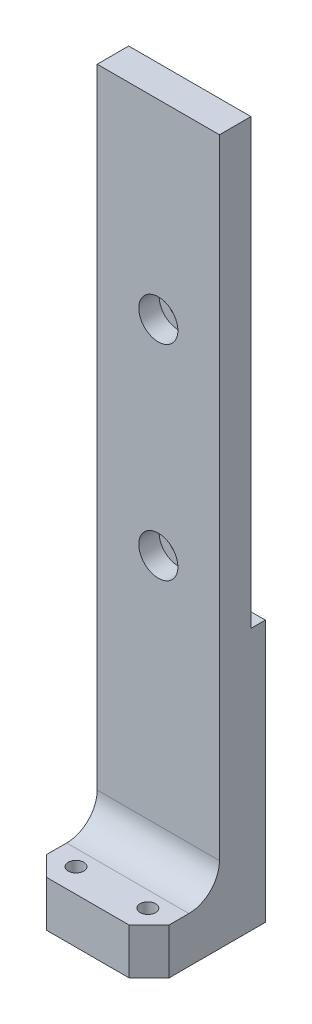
SolidWorks part; units mm, degrees
ref_plane "Front" through (0, 0, 0) normal (0, 0, 1) x (1, 0, 0)
ref_plane "Top" through (0, 0, 0) normal (0, 1, 0) x (1, 0, 0)
ref_plane "center" through (0, 0, 0) normal (1, 0, 0) x (0, 0, -1)
sketch "Sketch1" plane through (0, 0, 0) normal (0, 0, 1) x (1, 0, 0)
  line L1 (-10.16, 20.32) -> (10.16, 20.32)
  line L2 (-10.16, 20.32) -> (-10.16, -69.85)
  line L3 (-10.16, -69.85) -> (10.16, -69.85)
  line L4 (10.16, 20.32) -> (10.16, -69.85)
  point P4 (0, 20.32)
  dimension "D1" = 20.32
  dimension "D2" = 90.17
  dimension "D3" = 20.32
extrude "Extrude1" add sketch "Sketch1" along normal blind 15.24
sketch "Sketch4" plane through (0, 0, 0) normal (0, 0, 1) x (1, 0, 0)
  line L0 (-10.16, 20.32) -> (-10.16, -69.85) construction
  line L1 (10.16, 20.32) -> (-10.16, 20.32)
  line L2 (10.16, 20.32) -> (10.16, 12.32)
  line L3 (10.16, 12.32) -> (-10.16, 12.32)
  line L4 (-10.16, 20.32) -> (-10.16, 12.32)
  line L6 (10.16, 20.32) -> (-10.16, 20.32) construction
  line L7 (10.16, -69.85) -> (10.16, 20.32) construction
  dimension "D1" = 8
sketch "Sketch5" plane through (0, -69.85, 0) normal (0, -1, 0) x (1, 0, 0)
  line L1 (-10.16, 15.24) -> (10.16, 15.24)
  line L2 (-10.16, 15.24) -> (-10.16, 7.62)
  line L3 (-10.16, 7.62) -> (10.16, 7.62)
  line L4 (10.16, 15.24) -> (10.16, 7.62)
  line L5 (-10.16, 0) -> (10.16, 0) construction
  line L6 (10.16, 15.24) -> (10.16, 0) construction
  dimension "D1" = 7.62
extrude "Extrude2" add sketch "Sketch5" along normal blind 27.0002
sketch "Sketch10" plane through (0, 0, 15.24) normal (0, 0, 1) x (1, 0, 0)
  line L0 (-10.16, 20.32) -> (-10.16, -96.8502) construction
  line L1 (10.16, -96.8502) -> (-10.16, -96.8502)
  line L2 (10.16, -96.8502) -> (10.16, -89.2302)
  line L3 (10.16, -89.2302) -> (-10.16, -89.2302)
  line L4 (-10.16, -96.8502) -> (-10.16, -89.2302)
  dimension "D1" = 7.62
extrude "Extrude3" add sketch "Sketch10" along normal blind 11.6953
sketch "Sketch11" plane through (0, 0, 0) normal (0, 0, -1) x (-1, 0, 0)
  line L0 (-10.16, 20.32) -> (10.16, 20.32) construction
  line L1 (10.16, 20.32) -> (-10.16, 20.32)
  line L2 (10.16, 20.32) -> (10.16, -69.85)
  line L3 (10.16, -69.85) -> (-10.16, -69.85)
  line L4 (-10.16, 20.32) -> (-10.16, -69.85)
  line L6 (10.16, 20.32) -> (10.16, -69.85) construction
extrude "Cut-Extrude4" cut sketch "Sketch11" against normal up to surface (7.62 mm away)
sketch "Sketch13" plane through (0, 0, 7.62) normal (0, 0, -1) x (-1, 0, 0)
  line L1 (-10.16, 20.32) -> (10.16, 20.32)
  line L2 (-10.16, 20.32) -> (-10.16, -53.34)
  line L3 (-10.16, -53.34) -> (10.16, -53.34)
  line L4 (10.16, 20.32) -> (10.16, -53.34)
  line L5 (10.16, -96.8502) -> (10.16, 20.32) construction
  line L6 (10.16, 20.32) -> (-10.16, 20.32) construction
  line L8 (-10.16, -96.8502) -> (-10.16, 20.32) construction
  dimension "D1" = 73.66
extrude "Cut-Extrude6" cut sketch "Sketch13" against normal blind 2.3876
fillet "Fillet1" radius 5.08 1 edges
hole_wizard "#5-40 Tapped Hole1" positions "Sketch9" profile "Sketch8" tap size "#5-40" standard "Ansi Inch"
sketch "Sketch9" plane through (0, -96.8502, 0) normal (0, -1, 0) x (1, 0, 0)
  line L0 (10.16, 26.9353) -> (10.16, 7.62) construction
  line L1 (10.16, 26.9353) -> (-10.16, 7.62) construction
  line L4 (-10.16, 7.62) -> (-10.16, 26.9353) construction
  point P0 (5.969, 11.6038)
  point P1 (-5.969, 11.6038)
  point P17 (-5.969, 22.9515)
  point P26 (5.969, 22.9515)
  dimension "D1" = 4.191
  dimension "D3" = 4.191
sketch "Sketch8" plane through (5.969, -96.8502, 11.6038) normal (1, 0, 0) x (0, 0, -1)
  line L0 (0, 0) -> (0, 9.0295)
  line L1 (0, 9.0295) -> (1.289, 8.255)
  line L2 (1.289, 8.255) -> (1.289, 0)
  line L5 (1.289, 0) -> (0, 0)
  line L10 (0, 9.0295) -> (-1.2891, 8.255) construction
  line L11 (0, -6.35) -> (0, 107.95) construction
  dimension "Tap Drill Dia." = 2.5781
  dimension "Tap Drill Depth" = 8.255
  dimension "Drill Angle" = 118
hole_wizard "CBORE for M3 SHCS1" positions "3DSketch1" profile "Sketch15" counterbore size "M3" standard "Ansi Metric"
sketch3d "3DSketch1"
  line L0 (10.16, 20.32, 15.24) -> (-10.16, 20.32, 15.24) construction
  line L1 (-10.16, 20.32, 15.24) -> (-10.16, -84.1502, 15.24) construction
  point P0 (0, -21.68, 15.24)
  point P1 (0, 12.32, 15.24)
  dimension "D1" = 8
  dimension "D2" = 42
  dimension "D3" = 10.16
  dimension "D4" = 10.16
sketch "Sketch15" plane through (0, -21.68, 15.24) normal (1, 0, 0) x (0, -1, 0)
  line L0 (0, 0) -> (0, 7.62)
  line L1 (0, 7.62) -> (1.7, 7.62)
  line L3 (1.7, 7.62) -> (1.7, 2.7)
  line L4 (1.7, 2.7) -> (3.25, 2.7)
  line L5 (3.25, 2.7) -> (3.25, 0)
  line L7 (3.25, 0) -> (0, 0)
  line L11 (0, -6.35) -> (0, 107.95) construction
  dimension "Thru Hole Dia." = 3.4
  dimension "Thru Hole Depth" = 7.62
  dimension "C'Bore Dia." = 6.5
  dimension "C'Bore Depth" = 2.7
chamfer "Chamfer2" distance 3.302 angle 45 2 edges at (10.16, -93.0402, 26.9353) (-10.16, -93.0402, 26.9353)
sketch "Sketch16" plane through (0, 0, 15.24) normal (0, 0, 1) x (1, 0, 0)
  line L0 (10.16, -53.34) -> (-10.16, -53.34) construction
  line L1 (10.16, -53.34) -> (-10.16, -53.34)
hole_wizard "CBORE for M3 SHCS2" positions "3DSketch2" profile "Sketch17" counterbore size "M3" standard "Ansi Metric"
sketch3d "3DSketch2"
  line L1 (10.16, 20.32, 0) -> (-10.16, 20.32, 0) construction
  line L2 (10.16, 20.32, 15.24) -> (-10.16, 20.32, 15.24) construction
  point P0 (0, -45.339, 15.24)
  point P2 (0, -11.3284, 15.24)
  point P31 (0, 20.32, 15.24)
  dimension "D1" = 51.5112
  dimension "D2" = 34.0106
sketch "Sketch17" plane through (0, -45.339, 15.24) normal (1, 0, 0) x (0, -1, 0)
  line L0 (0, 0) -> (0, 7.62)
  line L1 (0, 7.62) -> (1.6, 7.62)
  line L3 (1.6, 7.62) -> (1.6, 3.381)
  line L4 (1.6, 3.381) -> (3.25, 3.381)
  line L5 (3.25, 3.381) -> (3.25, 0)
  line L7 (3.25, 0) -> (0, 0)
  line L11 (0, -6.35) -> (0, 107.95) construction
  dimension "Thru Hole Dia." = 3.2
  dimension "Thru Hole Depth" = 7.62
  dimension "C'Bore Dia." = 6.5
  dimension "C'Bore Depth" = 3.381
hole_wizard "M3x0.5 Tapped Hole1" positions "3DSketch3" profile "Sketch18" tap size "M3x0.5" standard "Ansi Metric"
sketch3d "3DSketch3"
  line L0 (-10.16, -96.8502, 23.6333) -> (-10.16, -96.8502, 7.62) construction
  line L1 (-10.16, -96.8502, 7.62) -> (-10.16, -53.34, 7.62) construction
  point P0 (-10.16, -81.6102, 11.43)
  dimension "D1" = 15.24
  dimension "D2" = 3.81
sketch "Sketch18" plane through (-10.16, -81.6102, 11.43) normal (0, 1, 0) x (0, 0, 1)
  line L0 (0, 0) -> (0, 8.3711)
  line L1 (0, 8.3711) -> (1.25, 7.62)
  line L2 (1.25, 7.62) -> (1.25, 0)
  line L5 (1.25, 0) -> (0, 0)
  line L10 (0, 8.3711) -> (-1.25, 7.62) construction
  line L11 (0, -6.35) -> (0, 107.95) construction
  dimension "Tap Drill Dia." = 2.5
  dimension "Tap Drill Depth" = 7.62
  dimension "Drill Angle" = 118
